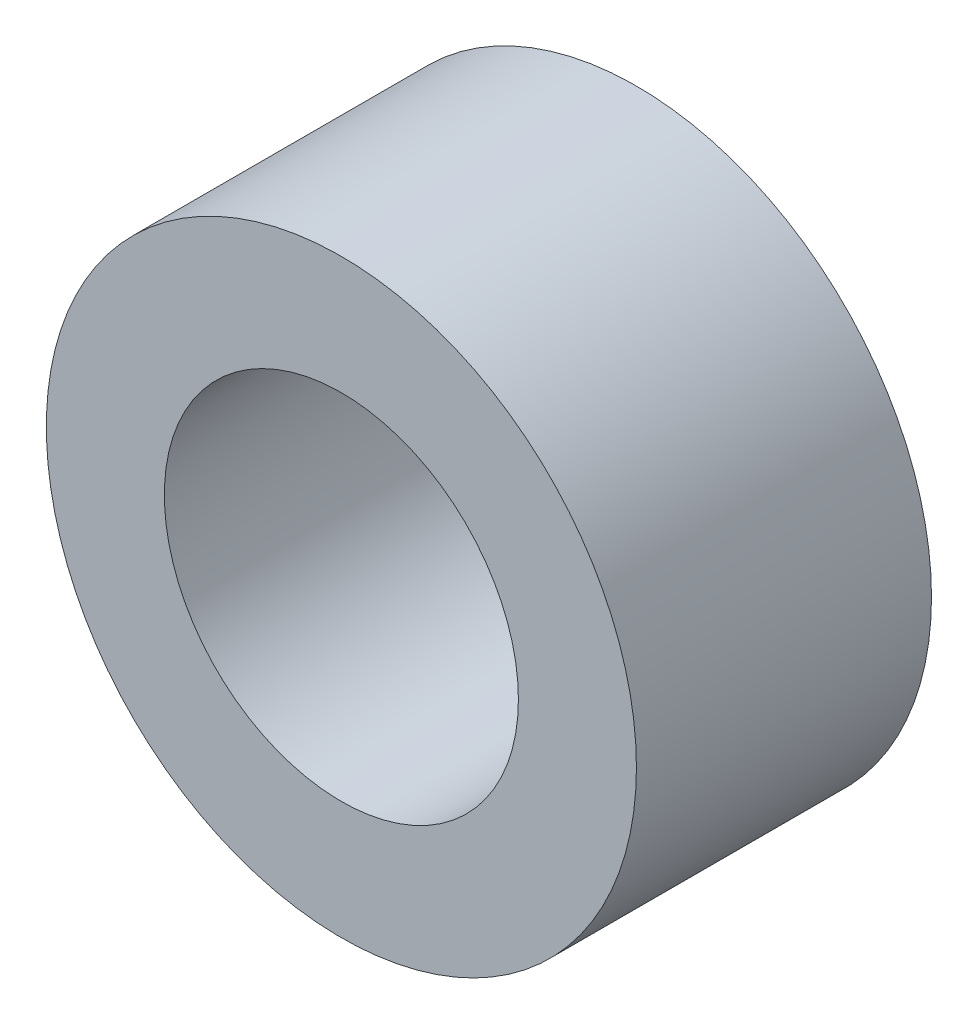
SolidWorks part; units mm, degrees
ref_plane "face" through (0, 0, 0) normal (0, 0, 1) x (1, 0, 0)
ref_plane "dessus" through (0, 0, 0) normal (0, 1, 0) x (1, 0, 0)
ref_plane "profil" through (0, 0, 0) normal (1, 0, 0) x (0, 0, -1)
sketch "Esquisse1" plane through (0, 0, 0) normal (0, 0, 1) x (1, 0, 0)
  circle A0 centre (0, 0) radius 10
  circle A1 centre (0, 0) radius 6
  dimension "D1" = 20
  dimension "D2" = 12
extrude "Base-Extrusion" add sketch "Esquisse1" along normal blind 10
